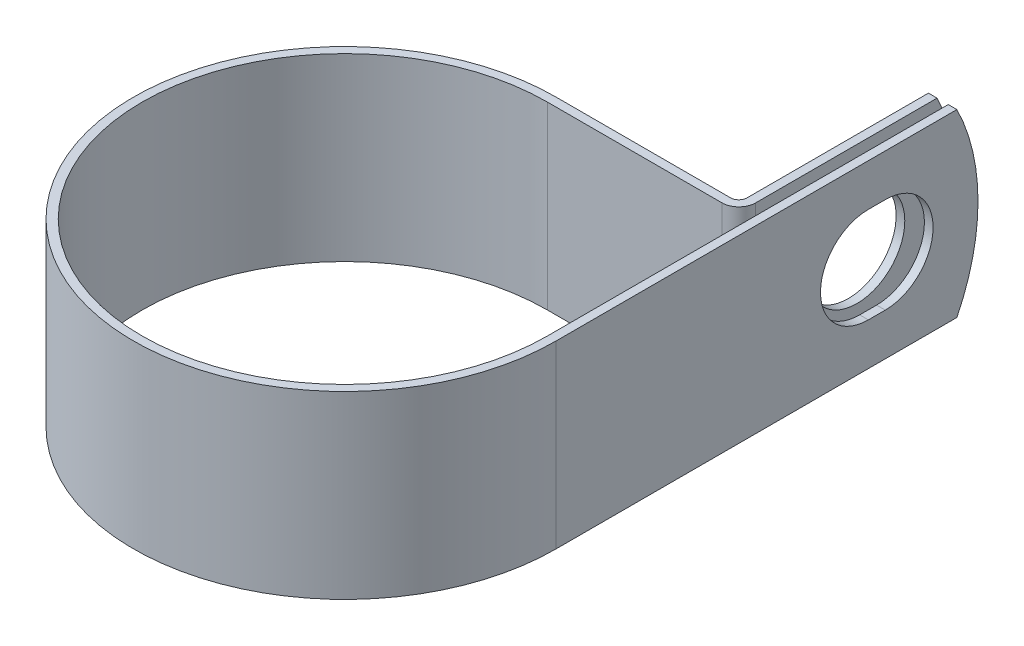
SolidWorks part; units mm, degrees
ref_plane "Front Plane" through (0, 0, 0) normal (0, 0, 1) x (1, 0, 0)
ref_plane "Top Plane" through (0, 0, 0) normal (0, 1, 0) x (1, 0, 0)
ref_plane "Right Plane" through (0, 0, 0) normal (1, 0, 0) x (0, 0, -1)
sketch "Sketch1" plane through (0, 0, 0) normal (0, 1, 0) x (1, 0, 0)
  line L0 (0, 28.575) -> (24.6228, 28.575)
  line L1 (28.575, 0) -> (28.575, 28.575)
  line L2 (27.0002, 59.5122) -> (27.0002, 30.9524)
  line L5 (28.575, 28.575) -> (28.575, 59.5122)
  arc A0 (0, 28.575) -> (28.575, 0) centre (0, 0) ccw
  arc A3 (24.6228, 28.575) -> (27.0002, 30.9524) centre (24.6228, 30.9524) ccw
extrude "Extrude-Thin1" add sketch "Sketch1" along normal mid plane 25.4 thin
sketch "Sketch2" plane through (25.781, 0, 0) normal (-1, 0, 0) x (0, 0, 1)
  line L0 (-59.5122, 12.7) -> (-59.5122, -12.7) construction
  line L7 (0, 12.7) -> (0, -12.7) construction
  circle A0 centre (-45.2374, 0) radius 6.7437
  point P2 (-59.5122, 0)
extrude "Cut-Extrude1" cut sketch "Sketch2" against normal up to surface (1.2192 mm away)
sketch "Sketch3" plane through (29.7942, 0, 0) normal (1, 0, 0) x (0, 0, -1)
  line L0 (44.0436, 0) -> (46.4312, 0) construction
  line L1 (44.0436, 6.7437) -> (46.4312, 6.7437)
  line L2 (44.0436, -6.7437) -> (46.4312, -6.7437)
  line L3 (59.5122, 12.7) -> (59.5122, -12.7) construction
  arc A0 (44.0436, 6.7437) -> (44.0436, -6.7437) centre (44.0436, 0) ccw
  arc A1 (46.4312, -6.7437) -> (46.4312, 6.7437) centre (46.4312, 0) ccw
  point P3 (45.2374, 0)
  point P8 (59.5122, 0)
  point P11 (37.2999, 0)
  point P12 (53.1749, 0)
extrude "Cut-Extrude2" cut sketch "Sketch3" against normal up to surface (1.2192 mm away)
sketch "Sketch4" plane through (25.781, 0, 0) normal (-1, 0, 0) x (0, 0, 1)
  line L0 (-59.5122, 12.7) -> (-59.5122, -12.7)
  line L1 (-59.5122, 12.7) -> (-56.5349, 12.7)
  line L2 (-59.5122, 12.7) -> (-30.9524, 12.7) construction
  line L3 (-59.5122, -12.7) -> (-56.5349, -12.7)
  line L4 (-59.5122, -12.7) -> (-30.9524, -12.7) construction
  arc A0 (-56.5349, 12.7) -> (-56.5349, -12.7) centre (-30.9372, 0) ccw
extrude "Cut-Extrude3" cut sketch "Sketch4" against normal through all contours A0 M4 M5 | A0 L0 M2
equation "\"D1@Sketch3\" = \"D2@Sketch2\""
equation "\"D7@Sketch1\" = \"D3@Sketch2\" + \"D1@Sketch3\""
equation "\"D1@Sketch4\" = ( \"D1@Extrude-Thin1\" + .125 ) * 2"
equation "\"D2@Sketch1\"=1.95*\"D5@Extrude-Thin1\""
equation "\"D2@Sketch3\" = \"D1@Sketch2\""
